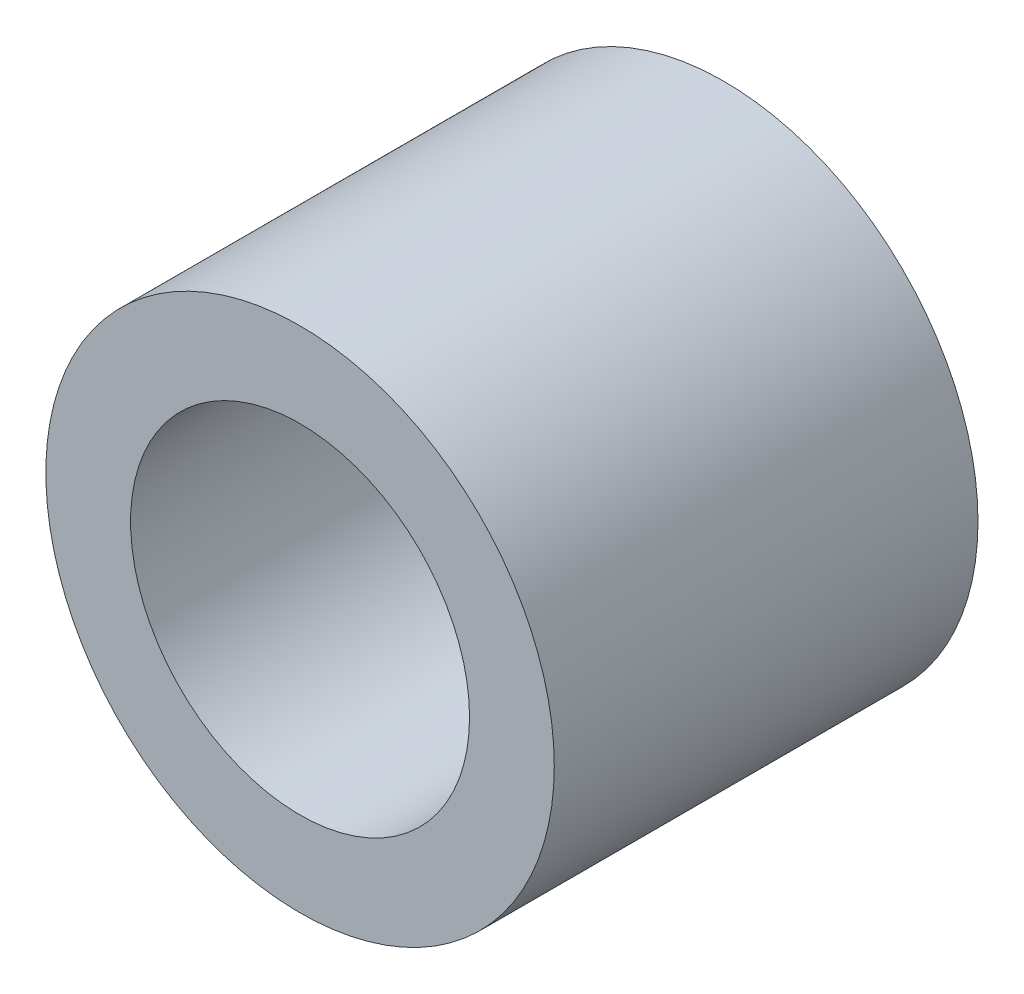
SolidWorks part; units mm, degrees
ref_plane "Ebene vorne" through (0, 0, 0) normal (0, 0, 1) x (1, 0, 0)
ref_plane "Ebene oben" through (0, 0, 0) normal (0, 1, 0) x (1, 0, 0)
ref_plane "Ebene rechts" through (0, 0, 0) normal (1, 0, 0) x (0, 0, -1)
sketch "Skizze1" plane through (0, 0, 0) normal (0, 0, 1) x (1, 0, 0)
  circle A0 centre (0, 0) radius 10
  circle A1 centre (0, 0) radius 15
  dimension "D1" = 20
  dimension "D2" = 30
extrude "Aufsatz-Linear austragen1" add sketch "Skizze1" along normal blind 25
